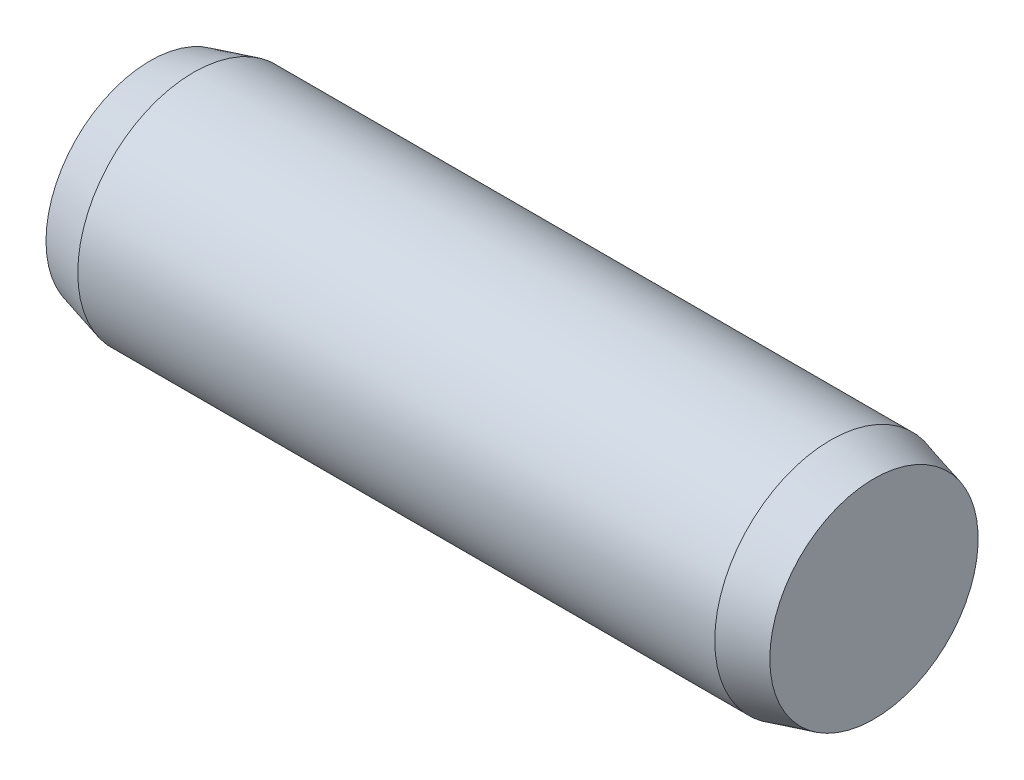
SolidWorks part; units mm, degrees
ref_plane "Front" through (0, 0, 0) normal (0, 0, 1) x (1, 0, 0)
ref_plane "Top" through (0, 0, 0) normal (0, 1, 0) x (1, 0, 0)
ref_plane "Right" through (0, 0, 0) normal (1, 0, 0) x (0, 0, -1)
other "Configuration Table"
sketch "Sketch1" plane through (0, 0, 0) normal (0, 0, 1) x (1, 0, 0)
  line L0 (0, 0) -> (50, 0)
  line L1 (50, 0) -> (50, 7.1962)
  line L2 (50, 7.1962) -> (47, 8)
  line L3 (47, 8) -> (3, 8)
  line L4 (3, 8) -> (0, 7.1962)
  line L5 (0, 7.1962) -> (0, 0)
  line L6 (-1.6557, 0) -> (2.6973, 0) construction
revolve "Base-Revolve" add sketch "Sketch1" angle 360 about L6
equation "\"D6@Sketch1\" = \"c@Sketch1\""
